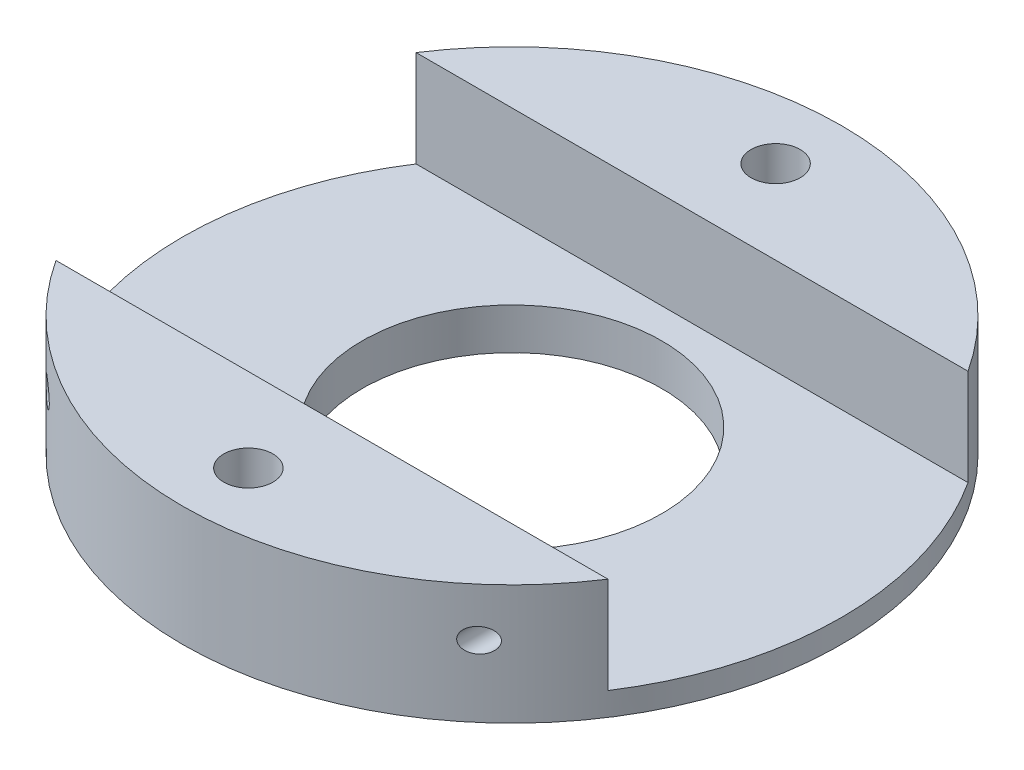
SolidWorks part; units mm, degrees
ref_plane "Front Plane" through (0, 0, 0) normal (0, 0, 1) x (1, 0, 0)
ref_plane "Top Plane" through (0, 0, 0) normal (0, 1, 0) x (1, 0, 0)
ref_plane "Right Plane" through (0, 0, 0) normal (1, 0, 0) x (0, 0, -1)
sketch "Sketch1" plane through (0, 0, 0) normal (0, 1, 0) x (1, 0, 0)
  circle A0 centre (0, 0) radius 27.5
  dimension "D1" = 55
extrude "Boss-Extrude1" add sketch "Sketch1" along normal blind 10
sketch "Sketch2" plane through (0, 10, 0) normal (0, 1, 0) x (1, 0, 0)
  line L1 (-30, -15.025) -> (30, -15.025)
  line L2 (-30, -15.025) -> (-30, 15.025)
  line L3 (-30, 15.025) -> (30, 15.025)
  line L4 (30, -15.025) -> (30, 15.025)
  line L5 (-30, -15.025) -> (30, 15.025) construction
  line L6 (-30, 15.025) -> (30, -15.025) construction
  point P0 (0, 0)
  dimension "D1" = 30.05
  dimension "D2" = 60
extrude "Cut-Extrude1" cut sketch "Sketch2" against normal blind 8.05
hole_wizard "Ø4.1 (4.1) Diameter Hole1" positions "Sketch5" profile "Sketch3" hole size "Ø4.1" standard "ANSI Metric"
sketch "Sketch5" plane through (0, 10, 0) normal (0, 1, 0) x (1, 0, 0)
  line L0 (0, 22) -> (0, 0) construction
  line L1 (0, 0) -> (0, -22) construction
  point P0 (0, 22)
  point P2 (0, -22)
  dimension "D1" = 22
sketch "Sketch3" plane through (0, 10, -22) normal (1, 0, 0) x (0, 0, 1)
  line L0 (0, 0) -> (0, 10)
  line L1 (0, 10) -> (2.05, 10)
  line L2 (2.05, 10) -> (2.05, 0)
  line L5 (2.05, 0) -> (0, 0)
  line L11 (0, -6.35) -> (0, 107.95) construction
  dimension "Thru Hole Dia." = 4.1
  dimension "Thru Hole Depth" = 10
sketch "Sketch7" plane through (0, 0, 0) normal (0, 0, 1) x (1, 0, 0)
  line L0 (-23.0326, 1.95) -> (-27.5, 1.95) construction
  line L1 (0, 10) -> (0, 1.95) construction
  line L2 (-18, 5.95) -> (0, 5.95) construction
  line L3 (0, 5.95) -> (18, 5.95) construction
  circle A0 centre (-18, 5.95) radius 1
  circle A1 centre (18, 5.95) radius 1
  dimension "D2" = 18
  dimension "D3" = 2
  dimension "D4" = 2
  dimension "D1" = 4
extrude "Cut-Extrude3" cut sketch "Sketch7" along normal blind 25
sketch "Sketch8" plane through (0, 0, 0) normal (0, -1, 0) x (-1, 0, 0)
  circle A0 centre (0, 0) radius 14.45
  dimension "D1" = 28.9
extrude "Boss-Extrude2" add sketch "Sketch8" along normal blind 1.5
sketch "Sketch9" plane through (0, 1.95, 0) normal (0, 1, 0) x (1, 0, 0)
  circle A0 centre (0, 0) radius 12.5
  dimension "D1" = 25
extrude "Cut-Extrude4" cut sketch "Sketch9" against normal through all
